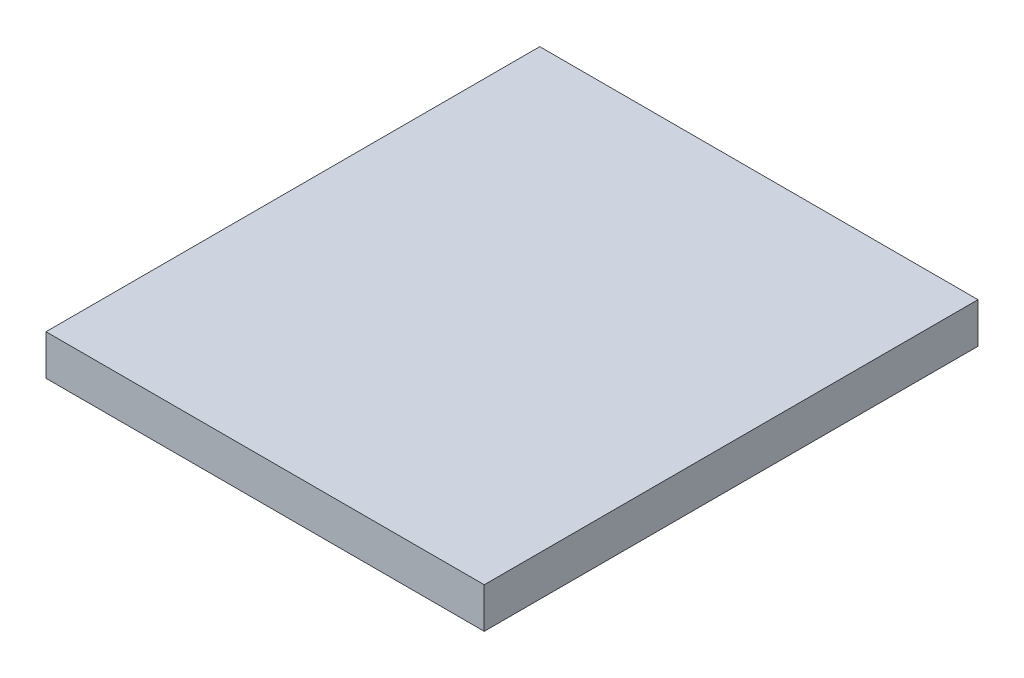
SolidWorks part; units mm, degrees
ref_plane "Front Plane" through (0, 0, 0) normal (0, 0, 1) x (1, 0, 0)
ref_plane "Top Plane" through (0, 0, 0) normal (0, 1, 0) x (1, 0, 0)
ref_plane "Right Plane" through (0, 0, 0) normal (1, 0, 0) x (0, 0, -1)
sketch "Sketch1" plane through (0, 0, 0) normal (0, 0, 1) x (1, 0, 0)
  line L1 (0, 0) -> (22.5441, 0)
  line L2 (0, 0) -> (0, -2.0764)
  line L3 (0, -2.0764) -> (22.5441, -2.0764)
  line L4 (22.5441, 0) -> (22.5441, -2.0764)
extrude "Extrude1" add sketch "Sketch1" along normal blind 25.4
